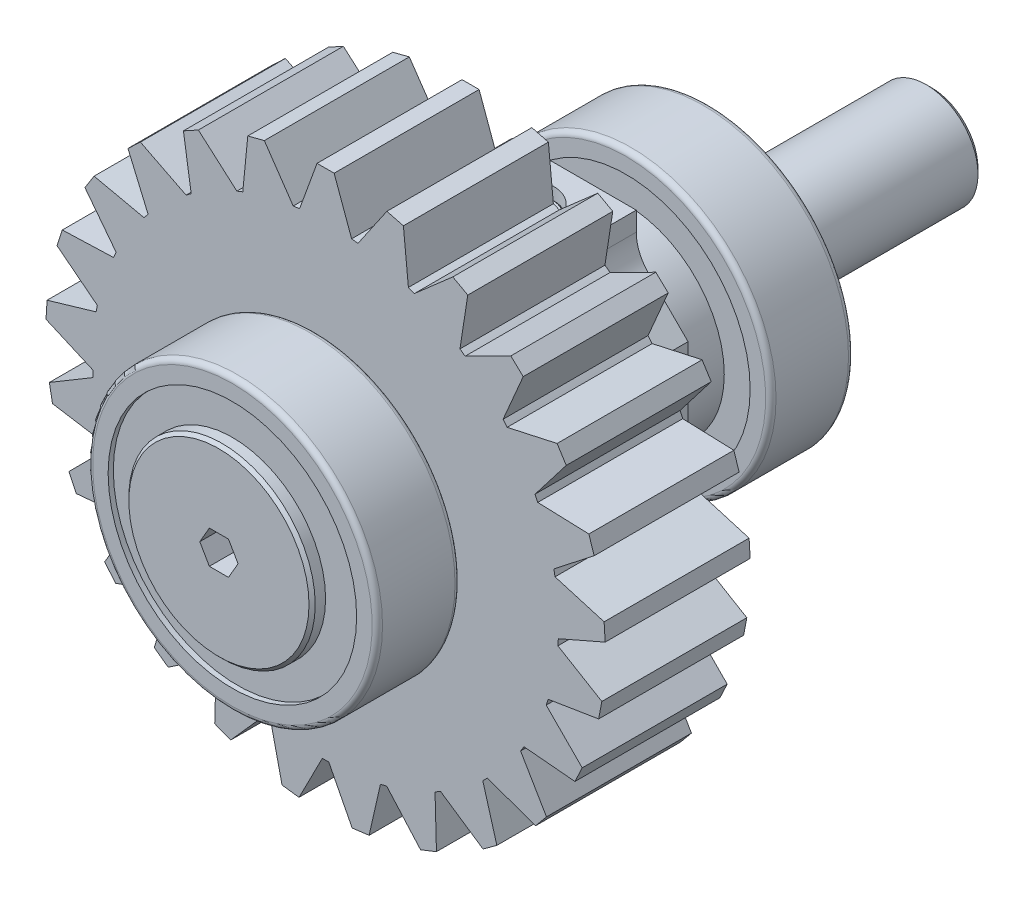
SolidWorks part; units mm, degrees
ref_plane "Front" through (0, 0, 0) normal (0, 0, 1) x (1, 0, 0)
ref_plane "Top" through (0, 0, 0) normal (0, 1, 0) x (1, 0, 0)
ref_plane "Right" through (0, 0, 0) normal (1, 0, 0) x (0, 0, -1)
other "Join1"
other "screw_set_tip_6x6<2>@gbox_input"
other "screw_set_tip_6x6<1>@gbox_input"
other "screw_tapper_head_5x15<1>@gbox_input"
other "wheel_gbox_sft_mid_washer<1>@gbox_input"
other "spacer_10x18x014mm<1>@gbox_input"
other "bearing_12x28x8mm<2>@gbox_input"
other "bearing_12x28x8mm<1>@gbox_input"
other "spacer_12x20x1mm<1>@gbox_input"
other "spacer_12x18x5mm<1>@gbox_input"
other "wheel_gbox_pinion_1s<1>@gbox_input"
other "wheel_gbox_shaft_input<1>@gbox_input"
